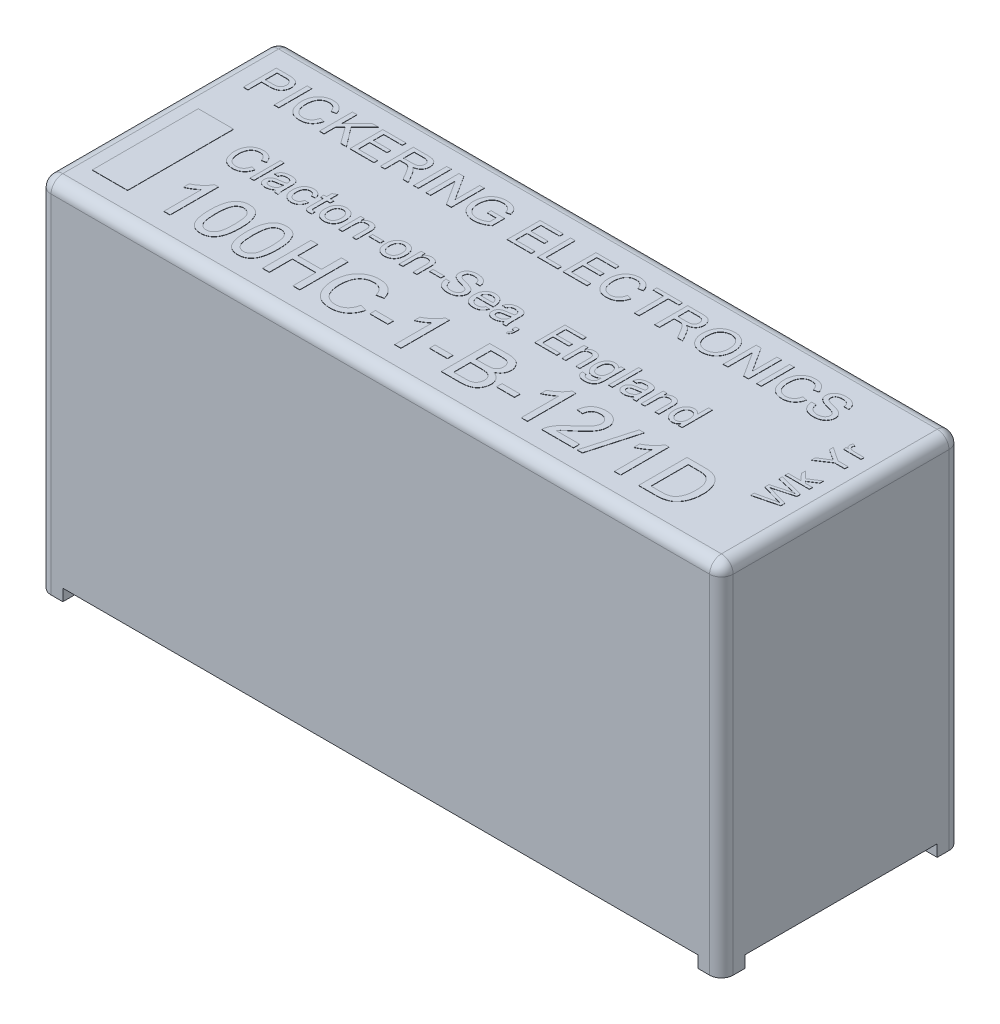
SolidWorks part; units mm, degrees
ref_plane "Front Plane" through (0, 0, 0) normal (0, 0, 1) x (1, 0, 0)
ref_plane "Top Plane" through (0, 0, 0) normal (0, 1, 0) x (1, 0, 0)
ref_plane "Right Plane" through (0, 0, 0) normal (1, 0, 0) x (0, 0, -1)
sketch "Sketch1" plane through (0, 0, 0) normal (0, 1, 0) x (1, 0, 0)
  line L1 (-14.478, -5.08) -> (14.478, -5.08)
  line L2 (-14.478, -5.08) -> (-14.478, 5.08)
  line L3 (-14.478, 5.08) -> (14.478, 5.08)
  line L4 (14.478, -5.08) -> (14.478, 5.08)
  line L5 (-14.478, -5.08) -> (14.478, 5.08) construction
  line L6 (-14.478, 5.08) -> (14.478, -5.08) construction
  point P0 (0, 0)
  dimension "D1" = 28.956
  dimension "D2" = 10.16
extrude "Boss-Extrude1" add sketch "Sketch1" along normal blind 15.24
sketch "Sketch2" plane through (0, 0, 5.08) normal (0, 0, 1) x (1, 0, 0)
  line L0 (-14.478, 0) -> (14.478, 0) construction
  line L1 (-13.478, 0) -> (13.478, 0)
  line L2 (-13.478, 0) -> (-13.478, 0.5)
  line L3 (-13.478, 0.5) -> (13.478, 0.5)
  line L4 (13.478, 0) -> (13.478, 0.5)
  line L5 (-14.478, 15.24) -> (-14.478, 0) construction
  line L6 (14.478, 15.24) -> (14.478, 0) construction
  dimension "D1" = 1
  dimension "D2" = 1
  dimension "D3" = 0.5
extrude "Cut-Extrude1" cut sketch "Sketch2" against normal through all
sketch "Sketch3" plane through (14.478, 0, 0) normal (1, 0, 0) x (0, 0, -1)
  line L0 (-5.08, 0) -> (5.08, 0) construction
  line L1 (-4.08, 0) -> (4.08, 0)
  line L2 (-4.08, 0) -> (-4.08, 0.5)
  line L3 (-4.08, 0.5) -> (4.08, 0.5)
  line L4 (4.08, 0) -> (4.08, 0.5)
  line L5 (-5.08, 15.24) -> (-5.08, 0) construction
  line L6 (5.08, 15.24) -> (5.08, 0) construction
  dimension "D1" = 1
  dimension "D2" = 1
  dimension "D3" = 0.5
extrude "Cut-Extrude2" cut sketch "Sketch3" against normal through all
sketch "Sketch4" plane through (0, 0.5, 0) normal (0, -1, 0) x (1, 0, 0)
  line L0 (-14.478, 0) -> (14.478, 0) construction
  line L1 (-14.478, -4.08) -> (-14.478, 4.08) construction
  line L2 (14.478, -4.08) -> (14.478, 4.08) construction
  line L4 (13.478, 5.08) -> (-13.478, 5.08) construction
  line L5 (0, 5.08) -> (0, -5.08) construction
  line L6 (13.478, -5.08) -> (-13.478, -5.08) construction
  line L7 (-2.8, -0.125) -> (-2.3, -0.125)
  line L8 (-2.8, -0.125) -> (-2.8, 0.125)
  line L9 (-2.8, 0.125) -> (-2.3, 0.125)
  line L10 (-2.3, -0.125) -> (-2.3, 0.125)
  line L11 (-2.8, -0.125) -> (-2.3, 0.125) construction
  line L12 (-2.8, 0.125) -> (-2.3, -0.125) construction
  line L13 (-7.9, -0.125) -> (-7.4, -0.125)
  line L14 (-7.9, -0.125) -> (-7.9, 0.125)
  line L15 (-7.9, 0.125) -> (-7.4, 0.125)
  line L16 (-7.4, -0.125) -> (-7.4, 0.125)
  line L17 (-7.9, -0.125) -> (-7.4, 0.125) construction
  line L18 (-7.9, 0.125) -> (-7.4, -0.125) construction
  line L19 (2.3, -0.125) -> (2.8, -0.125)
  line L20 (2.3, -0.125) -> (2.3, 0.125)
  line L21 (2.3, 0.125) -> (2.8, 0.125)
  line L22 (2.8, -0.125) -> (2.8, 0.125)
  line L23 (2.3, -0.125) -> (2.8, 0.125) construction
  line L24 (2.3, 0.125) -> (2.8, -0.125) construction
  line L25 (7.4, -0.125) -> (7.9, -0.125)
  line L26 (7.4, -0.125) -> (7.4, 0.125)
  line L27 (7.4, 0.125) -> (7.9, 0.125)
  line L28 (7.9, -0.125) -> (7.9, 0.125)
  line L29 (7.4, -0.125) -> (7.9, 0.125) construction
  line L30 (7.4, 0.125) -> (7.9, -0.125) construction
  point P6 (-2.55, 0)
  point P17 (-7.65, 0)
  point P22 (2.55, 0)
  point P27 (7.65, 0)
  dimension "D1" = 5.1
  dimension "D2" = 5.1
  dimension "D3" = 5.1
  dimension "D4" = 0.5
  dimension "D5" = 0.25
extrude "Boss-Extrude2" add sketch "Sketch4" along normal blind 3.6854 separate body
fillet "Fillet2" radius 0.5 4 edges at (0, 15.24, 5.08) (-14.478, 15.24, 0) (0, 15.24, -5.08) (14.478, 15.24, 0)
fillet "Fillet3" radius 0.5 8 edges at (-14.3316, 15.0936, -4.9336) (14.3316, 15.0936, -4.9336) (14.3316, 15.0936, 4.9336) (-14.3316, 15.0936, 4.9336) (-14.478, 7.37, -5.08) (14.478, 7.37, -5.08) (14.478, 7.37, 5.08) (-14.478, 7.37, 5.08)
sketch "Sketch5" plane through (0, 15.24, 0) normal (0, 1, 0) x (1, 0, 0)
  line L0 (-13.478, 2.42) -> (10.7486, 2.42) construction
  line L1 (-11.228, -0.78) -> (8.6555, -0.78) construction
  line L2 (-11.228, -3.83) -> (12.0348, -3.83) construction
  line L3 (13.978, -5.08) -> (-13.978, -5.08) construction
  line L4 (-13.478, 0.67) -> (-11.978, 0.67)
  line L5 (-13.478, 0.67) -> (-13.478, -3.83)
  line L6 (-13.478, -3.83) -> (-11.978, -3.83)
  line L7 (-11.978, 0.67) -> (-11.978, -3.83)
  line L8 (-14.478, -4.58) -> (-14.478, 4.58) construction
  line L9 (13.478, -1.83) -> (13.478, 2.742) construction
  line L10 (14.478, 4.58) -> (14.478, -4.58) construction
  text T0 "PICKERING ELECTRONICS" font "Arial" height 1.4
  text T1 "Clacton-on-Sea, England" font "Arial" height in points 5
  text T2 "100HC-1-B-12/1D" font "Arial" height in points 8
  text T3 "Wk Yr" font "Arial" height in points 4
  dimension "D1" = 4.5
  dimension "D2" = 1.5
  dimension "D3" = 1.25
  dimension "D4" = 1
  dimension "D5" = 1.25
  dimension "D6" = 4.3
  dimension "D7" = 7.5
  dimension "D8" = 3.25
  dimension "D9" = 3.25
  dimension "D10" = 3.25
  dimension "D11" = 1
extrude "Print Details" add sketch "Sketch5" along normal blind 0.01 separate body
equation "\"1.251.20mm\"=1.2"
